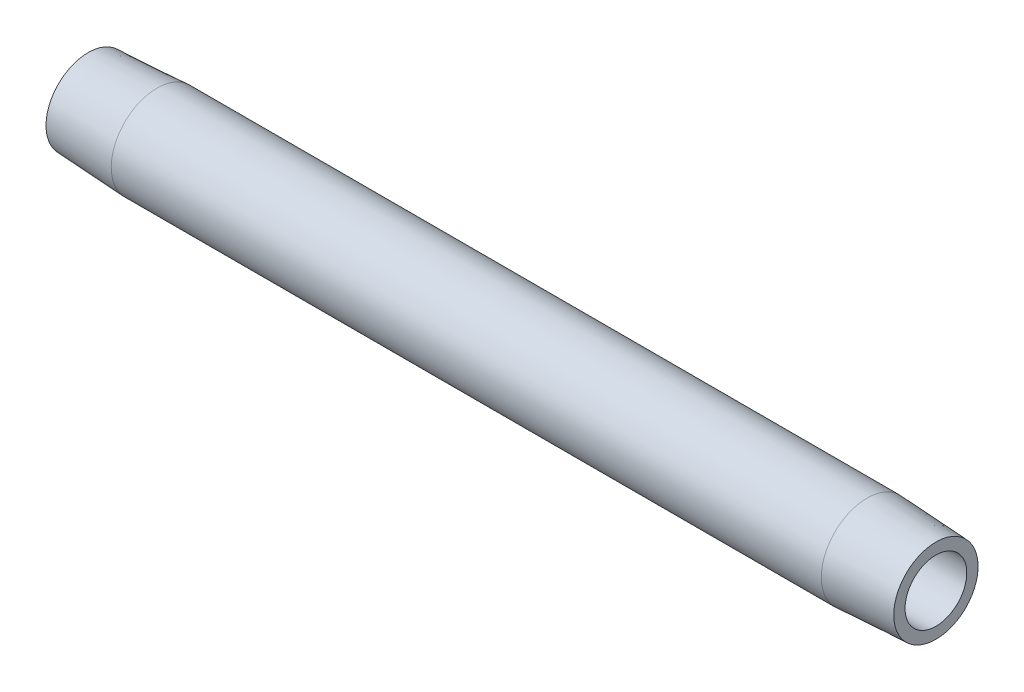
SolidWorks part; units mm, degrees
ref_plane "Front Plane" through (0, 0, 0) normal (0, 0, 1) x (1, 0, 0)
ref_plane "Top Plane" through (0, 0, 0) normal (0, 1, 0) x (1, 0, 0)
ref_plane "Right Plane" through (0, 0, 0) normal (1, 0, 0) x (0, 0, -1)
sketch "Sketch1" plane through (0, 0, 0) normal (0, 1, 0) x (1, 0, 0)
  line L6 (127, 4.6228) -> (0, 4.6228)
  line L7 (10.3124, 6.858) -> (0, 6.3175)
  line L8 (0, 6.3175) -> (0, 4.6228)
  line L9 (116.6876, 6.858) -> (10.3124, 6.858)
  line L10 (127, 6.3175) -> (116.6876, 6.858)
  line L11 (127, 4.6228) -> (127, 6.3175)
  line L12 (-6.376, 0) -> (49993.624, 0) construction
  dimension "D1" = 9.2456
  dimension "D2" = 13.716
  dimension "D3" = 3
  dimension "D4" = 3
  dimension "D5" = 127
  dimension "D6" = 10.3124
  dimension "D7" = 10.3124
revolve "Revolve1" add sketch "Sketch1" angle 360 about L12
